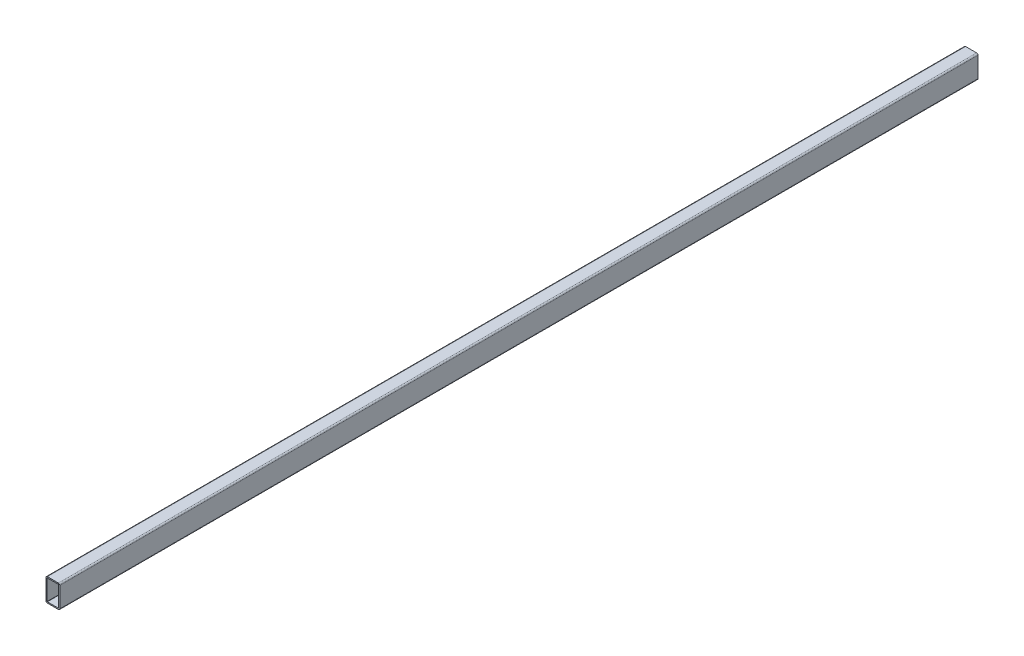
SolidWorks part; units mm, degrees
ref_plane "Спереди" through (0, 0, 0) normal (0, 0, 1) x (1, 0, 0)
ref_plane "Сверху" through (0, 0, 0) normal (0, 1, 0) x (1, 0, 0)
ref_plane "Справа" through (0, 0, 0) normal (1, 0, 0) x (0, 0, -1)
sketch "Эскиз1" plane through (0, 0, 0) normal (0, 0, 1) x (1, 0, 0)
  line L0 (-3, -2.5) -> (-27, -2.5)
  line L1 (-3, 0) -> (-27, 0)
  line L2 (0, -3) -> (0, -47)
  line L3 (-3, -50) -> (-27, -50)
  line L4 (-30, -3) -> (-30, -47)
  line L5 (-27.5, -3) -> (-27.5, -47)
  line L6 (-3, -47.5) -> (-27, -47.5)
  line L7 (-2.5, -3) -> (-2.5, -47)
  arc A0 (-27, 0) -> (-30, -3) centre (-27, -3) ccw
  arc A1 (0, -47) -> (-3, -50) centre (-3, -47) cw
  arc A2 (-27, -50) -> (-30, -47) centre (-27, -47) cw
  arc A3 (-3, 0) -> (0, -3) centre (-3, -3) cw
  arc A4 (-27, -2.5) -> (-27.5, -3) centre (-27, -3) ccw
  arc A5 (-27, -47.5) -> (-27.5, -47) centre (-27, -47) cw
  arc A6 (-2.5, -47) -> (-3, -47.5) centre (-3, -47) cw
  arc A7 (-3, -2.5) -> (-2.5, -3) centre (-3, -3) cw
  point P7 (-30, 0)
  point P10 (0, -50)
  point P15 (0, 0)
  dimension "D3" = 3
  dimension "D1" = 30
  dimension "D2" = 50
  dimension "D4" = 2.5
extrude "Бобышка-Вытянуть1" add sketch "Эскиз1" along normal blind 2000
